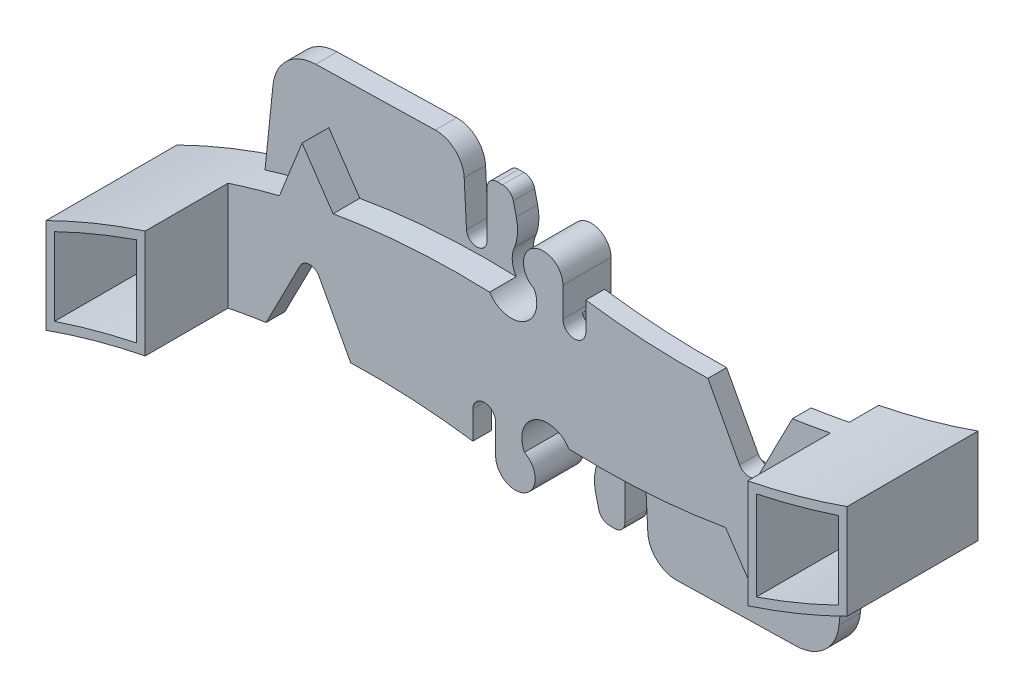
SolidWorks part; units mm, degrees
ref_plane "Спереди" through (0, 0, 0) normal (0, 0, 1) x (1, 0, 0)
ref_plane "Сверху" through (0, 0, 0) normal (0, 1, 0) x (1, 0, 0)
ref_plane "Справа" through (0, 0, 0) normal (1, 0, 0) x (0, 0, -1)
sketch "Эскиз1" plane through (0, 0, 0) normal (0, 0, 1) x (1, 0, 0)
  line L0 (-375.3024, 31.4014) -> (374.6976, 31.4014) construction
  line L24 (0, -241.3413) -> (0, -81.7204) construction
  line L25 (-375, -116.0042) -> (375, 116.0042) construction
  line L26 (375, -116.0042) -> (375, 116.0042) construction
  line L27 (-375, 116.0042) -> (375, 116.0042) construction
  line L28 (-375, -116.0042) -> (-375, 116.0042) construction
  line L29 (-375, -116.0042) -> (375, -116.0042) construction
  line L30 (-375, 116.0042) -> (375, -116.0042) construction
  line L31 (-212.6838, 78.1092) -> (-233.9079, 24.7709)
  line L32 (-212.6838, 78.1092) -> (-183.648, 35.3622)
  line L33 (-54.9859, 113.0917) -> (-50.0582, 113.0917)
  line L34 (-31.5, -57.5287) -> (-31.5, -85)
  line L35 (-64.536, 60.32) -> (-64.536, 103.5416)
  line L36 (-52.8148, -83.6396) -> (-52.8148, -57.5287)
  line L37 (-214.458, -22.1116) -> (-246.2919, -84.1777)
  line L38 (-85.939, 100.8712) -> (-83.813, 59.8211)
  line L39 (0, 0) -> (561.0349, 0) construction
  line L55 (-167.1856, -77.2946) -> (-196.7642, -22.1116)
  line L56 (-224.9261, 123.3927) -> (-113.0702, 126.0318)
  line L57 (-39.9761, 105.1282) -> (-37.178, 93.3762)
  line L58 (-272.3711, 14.0006) -> (-264.9369, 86.4136)
  line L59 (-282, 10.9287) -> (-282, -90.3668)
  line L60 (-374.8948, -27.081) -> (-374.8948, -116.0042)
  line L61 (0, 0) -> (-272.3711, 14.0006)
  line L62 (212.6838, -78.1092) -> (233.9079, -24.7709)
  line L63 (212.6838, -78.1092) -> (183.648, -35.3622)
  line L64 (54.9859, -113.0917) -> (50.0582, -113.0917)
  line L65 (31.5, 57.5287) -> (31.5, 85)
  line L66 (64.536, -60.32) -> (64.536, -103.5416)
  line L67 (52.92, 83.6396) -> (52.92, 57.5287)
  line L68 (214.458, 22.1116) -> (246.2919, 84.1777)
  line L69 (0, -70.9199) -> (0, 278.9356)
  line L70 (85.939, -100.8712) -> (83.813, -59.8211)
  line L71 (167.1856, 77.2946) -> (196.7642, 22.1116)
  line L72 (224.9261, -123.3927) -> (113.0702, -126.0318)
  line L73 (39.9761, -105.1282) -> (37.178, -93.3762)
  line L74 (272.3711, -14.0006) -> (264.9369, -86.4136)
  line L75 (282, -10.9287) -> (282, 90.3668)
  line L76 (375, 27.081) -> (375, 116.0042)
  line L77 (0, 0) -> (272.3711, -14.0006)
  arc A12 (4.564, 68.5354) -> (-38.7133, 68.2242) centre (-17, 58) cw
  arc A13 (-196.7642, -22.1116) -> (-214.458, -22.1116) centre (-205.6111, -26.8536) ccw
  arc A14 (-37.178, 93.3762) -> (-38.7133, 68.2242) centre (-79.3762, 83.3291) cw
  arc A15 (-64.536, 60.32) -> (-83.813, 59.8211) centre (-74.181, 60.32) cw
  arc A16 (-54.9859, 113.0917) -> (-64.536, 103.5416) centre (-54.9859, 103.5416) ccw
  arc A17 (-39.9761, 105.1282) -> (-50.0582, 113.0917) centre (-50.0582, 102.7277) ccw
  arc A18 (-224.9261, 123.3927) -> (-264.9369, 86.4136) centre (-223.9544, 82.2062) ccw
  arc A19 (-85.939, 100.8712) -> (-113.0702, 126.0318) centre (-112.4442, 99.4984) ccw
  arc A20 (-52.8148, -83.6396) -> (-374.8948, -116.0042) centre (-147.6226, -758.9402) ccw
  arc A21 (-31.5, -57.5287) -> (-52.8148, -57.5287) centre (-42.1574, -57.5287) ccw
  arc A22 (-37.0728, 45.0059) -> (-374.8948, -27.081) centre (-64.6411, -653.4149) ccw
  arc A23 (4.564, 68.5354) -> (31.5, 85) centre (13, 85) cw
  arc A25 (-4.564, -68.5354) -> (38.8196, -67.9952) centre (17, -58) cw
  arc A37 (196.7642, 22.1116) -> (214.458, 22.1116) centre (205.6111, 26.8536) ccw
  arc A38 (37.178, -93.3762) -> (38.8196, -67.9952) centre (79.2676, -83.3549) cw
  arc A39 (64.536, -60.32) -> (83.813, -59.8211) centre (74.181, -60.32) cw
  arc A40 (54.9859, -113.0917) -> (64.536, -103.5416) centre (54.9859, -103.5416) ccw
  arc A41 (39.9761, -105.1282) -> (50.0582, -113.0917) centre (50.0582, -102.7277) ccw
  arc A42 (224.9261, -123.3927) -> (264.9369, -86.4136) centre (223.9544, -82.2062) ccw
  arc A43 (85.939, -100.8712) -> (113.0702, -126.0318) centre (112.4442, -99.4984) ccw
  arc A44 (-4.564, -68.5354) -> (-31.5, -85) centre (-13, -85) cw
  arc A45 (52.92, 83.6396) -> (375, 116.0042) centre (147.7278, 758.9402) ccw
  arc A46 (31.5, 57.5287) -> (52.92, 57.5287) centre (42.21, 57.5287) ccw
  arc A47 (37.178, -45.0059) -> (375, 27.081) centre (64.7463, 653.4149) ccw
  dimension "D1" = 750
sketch "Эскиз2" plane through (0, 0, 0) normal (0, 0, 1) x (1, 0, 0)
  line L0 (-374.8948, -27.081) -> (-374.8948, -116.0042) construction
  line L1 (-52.8148, -83.6396) -> (-52.8148, -57.5287) construction
  line L2 (-31.5, -57.5287) -> (-31.5, -85) construction
  line L3 (39.9761, -105.1282) -> (37.178, -93.3762) construction
  line L4 (54.9859, -113.0917) -> (50.0582, -113.0917) construction
  line L5 (64.536, -60.32) -> (64.536, -103.5416) construction
  line L6 (85.939, -100.8712) -> (83.813, -59.8211) construction
  line L7 (224.9261, -123.3927) -> (113.0702, -126.0318) construction
  line L8 (272.3711, -14.0006) -> (264.9369, -86.4136) construction
  line L11 (-272.3711, 14.0006) -> (-264.9369, 86.4136) construction
  line L12 (-224.9261, 123.3927) -> (-113.0702, 126.0318) construction
  line L13 (-85.939, 100.8712) -> (-83.813, 59.8211) construction
  line L14 (-64.536, 60.32) -> (-64.536, 103.5416) construction
  line L15 (-54.9859, 113.0917) -> (-50.0582, 113.0917) construction
  line L16 (-39.9761, 105.1282) -> (-37.178, 93.3762) construction
  line L17 (31.5, 57.5287) -> (31.5, 85) construction
  line L18 (52.92, 83.6396) -> (52.92, 57.5287) construction
  line L19 (375, 27.081) -> (375, 116.0042) construction
  line L22 (-214.458, -22.1116) -> (-246.2919, -84.1777) construction
  line L23 (-167.1856, -77.2946) -> (-196.7642, -22.1116) construction
  line L27 (214.458, 22.1116) -> (246.2919, 84.1777) construction
  line L28 (167.1856, 77.2946) -> (196.7642, 22.1116) construction
  line L31 (-374.8948, -27.081) -> (-374.8948, -116.0042)
  line L32 (-52.8148, -83.6396) -> (-52.8148, -57.5287)
  line L33 (-31.5, -57.5287) -> (-31.5, -85)
  line L34 (39.9761, -105.1282) -> (37.178, -93.3762)
  line L35 (54.9859, -113.0917) -> (50.0582, -113.0917)
  line L36 (64.536, -60.32) -> (64.536, -103.5416)
  line L37 (85.939, -100.8712) -> (83.813, -59.8211)
  line L38 (224.9261, -123.3927) -> (113.0702, -126.0318)
  line L39 (272.3711, -14.0006) -> (264.9369, -86.4136)
  line L42 (-272.3745, 13.9668) -> (-264.9369, 86.4136)
  line L43 (-224.9261, 123.3927) -> (-113.0702, 126.0318)
  line L44 (-85.939, 100.8712) -> (-83.813, 59.8211)
  line L45 (-64.536, 60.32) -> (-64.536, 103.5416)
  line L46 (-54.9859, 113.0917) -> (-50.0582, 113.0917)
  line L47 (-39.9761, 105.1282) -> (-37.178, 93.3762)
  line L48 (31.5, 57.5287) -> (31.5, 85)
  line L49 (52.92, 83.6396) -> (52.92, 57.5287)
  line L50 (375, 27.081) -> (375, 116.0042)
  line L53 (-214.458, -22.1116) -> (-246.3005, -84.1943)
  line L54 (-167.184, -77.2975) -> (-196.7642, -22.1116)
  line L58 (214.458, 22.1116) -> (246.2919, 84.1777)
  line L59 (167.1856, 77.2946) -> (196.7642, 22.1116)
  arc A1 (-52.8148, -83.6396) -> (-374.8948, -116.0042) centre (-147.6226, -758.9402) ccw construction
  arc A2 (-31.5, -57.5287) -> (-52.8148, -57.5287) centre (-42.1574, -57.5287) ccw construction
  arc A3 (-31.5, -85) -> (-4.564, -68.5354) centre (-13, -85) ccw construction
  arc A4 (38.8196, -67.9952) -> (-4.564, -68.5354) centre (17, -58) ccw construction
  arc A5 (38.8196, -67.9952) -> (37.178, -93.3762) centre (79.2676, -83.3549) ccw construction
  arc A6 (39.9761, -105.1282) -> (50.0582, -113.0917) centre (50.0582, -102.7277) ccw construction
  arc A7 (54.9859, -113.0917) -> (64.536, -103.5416) centre (54.9859, -103.5416) ccw construction
  arc A8 (83.813, -59.8211) -> (64.536, -60.32) centre (74.181, -60.32) ccw construction
  arc A9 (85.939, -100.8712) -> (113.0702, -126.0318) centre (112.4442, -99.4984) ccw construction
  arc A10 (224.9261, -123.3927) -> (264.9369, -86.4136) centre (223.9544, -82.2062) ccw construction
  arc A11 (-224.9261, 123.3927) -> (-264.9369, 86.4136) centre (-223.9544, 82.2062) ccw construction
  arc A12 (-85.939, 100.8712) -> (-113.0702, 126.0318) centre (-112.4442, 99.4984) ccw construction
  arc A13 (-83.813, 59.8211) -> (-64.536, 60.32) centre (-74.181, 60.32) ccw construction
  arc A14 (-54.9859, 113.0917) -> (-64.536, 103.5416) centre (-54.9859, 103.5416) ccw construction
  arc A15 (-39.9761, 105.1282) -> (-50.0582, 113.0917) centre (-50.0582, 102.7277) ccw construction
  arc A16 (-38.7133, 68.2242) -> (-37.178, 93.3762) centre (-79.3762, 83.3291) ccw construction
  arc A17 (-38.7133, 68.2242) -> (4.564, 68.5354) centre (-17, 58) ccw construction
  arc A18 (31.5, 85) -> (4.564, 68.5354) centre (13, 85) ccw construction
  arc A19 (31.5, 57.5287) -> (52.92, 57.5287) centre (42.21, 57.5287) ccw construction
  arc A20 (52.92, 83.6396) -> (375, 116.0042) centre (147.7278, 758.9402) ccw construction
  arc A21 (37.178, -45.0059) -> (375, 27.081) centre (64.7463, 653.4149) ccw construction
  arc A22 (-196.7642, -22.1116) -> (-214.458, -22.1116) centre (-205.6111, -26.8536) ccw construction
  arc A23 (196.7642, 22.1116) -> (214.458, 22.1116) centre (205.6111, 26.8536) ccw construction
  arc A25 (-52.8148, -83.6396) -> (-167.184, -77.2975) centre (-147.6226, -758.9402) ccw
  arc A26 (-31.5, -57.5287) -> (-52.8148, -57.5287) centre (-42.1574, -57.5287) ccw
  arc A27 (-31.5, -85) -> (-4.564, -68.5354) centre (-13, -85) ccw
  arc A28 (38.8196, -67.9952) -> (-4.564, -68.5354) centre (17, -58) ccw
  arc A29 (38.8196, -67.9952) -> (37.178, -93.3762) centre (79.2676, -83.3549) ccw
  arc A30 (39.9761, -105.1282) -> (50.0582, -113.0917) centre (50.0582, -102.7277) ccw
  arc A31 (54.9859, -113.0917) -> (64.536, -103.5416) centre (54.9859, -103.5416) ccw
  arc A32 (83.813, -59.8211) -> (64.536, -60.32) centre (74.181, -60.32) ccw
  arc A33 (85.939, -100.8712) -> (113.0702, -126.0318) centre (112.4442, -99.4984) ccw
  arc A34 (224.9261, -123.3927) -> (264.9369, -86.4136) centre (223.9544, -82.2062) ccw
  arc A35 (-224.9261, 123.3927) -> (-264.9369, 86.4136) centre (-223.9544, 82.2062) ccw
  arc A36 (-85.939, 100.8712) -> (-113.0702, 126.0318) centre (-112.4442, 99.4984) ccw
  arc A37 (-83.813, 59.8211) -> (-64.536, 60.32) centre (-74.181, 60.32) ccw
  arc A38 (-54.9859, 113.0917) -> (-64.536, 103.5416) centre (-54.9859, 103.5416) ccw
  arc A39 (-39.9761, 105.1282) -> (-50.0582, 113.0917) centre (-50.0582, 102.7277) ccw
  arc A40 (-38.7133, 68.2242) -> (-37.178, 93.3762) centre (-79.3762, 83.3291) ccw
  arc A41 (-38.7133, 68.2242) -> (4.564, 68.5354) centre (-17, 58) ccw
  arc A42 (31.5, 85) -> (4.564, 68.5354) centre (13, 85) ccw
  arc A43 (31.5, 57.5287) -> (52.92, 57.5287) centre (42.21, 57.5287) ccw
  arc A44 (52.92, 83.6396) -> (167.1856, 77.2946) centre (147.7278, 758.9402) ccw
  arc A45 (272.3711, -14.0006) -> (375, 27.081) centre (64.7463, 653.4149) ccw
  arc A46 (-196.7642, -22.1116) -> (-214.458, -22.1116) centre (-205.6111, -26.8536) ccw
  arc A47 (196.7642, 22.1116) -> (214.458, 22.1116) centre (205.6111, 26.8536) ccw
  arc A48 (246.2919, 84.1777) -> (375, 116.0042) centre (147.7278, 758.9402) ccw
  arc A49 (-246.3005, -84.1943) -> (-374.8948, -116.0042) centre (-147.6226, -758.9402) ccw
  arc A50 (-272.3745, 13.9668) -> (-374.8948, -27.081) centre (-64.6411, -653.4149) ccw
extrude "Бобышка-Вытянуть1" add sketch "Эскиз2" along normal mid plane 45
sketch "Эскиз3" plane through (0, 0, 0) normal (0, 0, 1) x (1, 0, 0)
  line L0 (-212.6838, 78.1092) -> (-233.9079, 24.7709) construction
  line L1 (212.6838, -78.1092) -> (233.9079, -24.7709) construction
  line L2 (212.6838, -78.1092) -> (183.648, -35.3622) construction
  line L3 (-212.6838, 78.1092) -> (-183.648, 35.3622) construction
  line L4 (212.6838, -78.1092) -> (233.9079, -24.7709)
  line L5 (212.6838, -78.1092) -> (183.648, -35.3622)
  line L6 (-212.6838, 78.1092) -> (-183.6369, 35.346)
  line L7 (-212.6838, 78.1092) -> (-233.9195, 24.7417)
  line L8 (-374.8948, -27.081) -> (-374.8948, 190.3826)
  line L9 (-374.8948, 190.3826) -> (-22.4115, 190.3826)
  line L10 (-22.4115, 190.3826) -> (-22.4115, 44.2729)
  line L11 (375, 27.081) -> (375, -189.5585)
  line L12 (375, -189.5585) -> (28.8988, -189.5585)
  line L13 (28.8988, -189.5585) -> (28.8988, -44.6299)
  arc A0 (37.178, -45.0059) -> (375, 27.081) centre (64.7463, 653.4149) ccw construction
  arc A1 (-37.0728, 45.0059) -> (-374.8948, -27.081) centre (-64.6411, -653.4149) ccw construction
  arc A2 (28.8988, -44.6299) -> (183.648, -35.3622) centre (64.7463, 653.4149) ccw
  arc A3 (-22.4115, 44.2729) -> (-183.6369, 35.346) centre (-64.6411, -653.4149) ccw
  arc A4 (233.9079, -24.7709) -> (375, 27.081) centre (64.7463, 653.4149) ccw
  arc A5 (-233.9195, 24.7417) -> (-374.8948, -27.081) centre (-64.6411, -653.4149) ccw
extrude "Вырез-Вытянуть1" cut sketch "Эскиз3" along normal blind 22.5 and the other way blind 2.5
sketch "Эскиз4" plane through (0, 0, 0) normal (0, 0, 1) x (1, 0, 0)
  line L0 (282, -10.9287) -> (282, 90.3668) construction
  line L1 (-282, 10.9287) -> (-282, -90.3668) construction
  line L2 (32, 191.573) -> (32, 22.103)
  line L3 (0, 0) -> (272.3711, -14.0006) construction
  line L4 (282, 32.8769) -> (282, 90.3668)
  line L5 (-282, -32.8769) -> (-282, -90.3668)
  line L6 (55.7166, -2.864) -> (234.6899, -12.0637)
  line L7 (-234.6899, 12.0637) -> (-55.7166, 2.864)
  line L8 (-32, -226.8105) -> (-32, -22.103)
  line L9 (-282, -90.3668) -> (-32, -226.8105)
  line L10 (32, 191.573) -> (282, 90.3668)
  arc A0 (234.6899, -12.0637) -> (282, 32.8769) centre (237, 32.8769) ccw
  arc A1 (-234.6899, 12.0637) -> (-282, -32.8769) centre (-237, -32.8769) ccw
  arc A2 (32, 22.103) -> (55.7166, -2.864) centre (57, 22.103) ccw
  arc A3 (-32, -22.103) -> (-55.7166, 2.864) centre (-57, -22.103) ccw
  point P19 (32, -1.6449)
extrude "Вырез-Вытянуть2" cut sketch "Эскиз4" against normal blind 25 and the other way blind 5
sketch "Эскиз5" plane through (0, 0, 0) normal (0, 0, 1) x (1, 0, 0)
  line L0 (282, -10.9287) -> (282, 90.3668) construction
  line L1 (-282, 10.9287) -> (-282, -90.3668) construction
  line L2 (-374.8948, -27.081) -> (-374.8948, -116.0042) construction
  line L3 (375, 27.081) -> (375, 116.0042) construction
  line L4 (-282, 10.8943) -> (-282, -90.388)
  line L5 (-374.8948, -27.081) -> (-374.8948, -116.0042)
  line L6 (375, 27.081) -> (375, 116.0042)
  line L7 (282, -10.9287) -> (282, 90.3668)
  arc A0 (-52.8148, -83.6396) -> (-374.8948, -116.0042) centre (-147.6226, -758.9402) ccw construction
  arc A1 (-37.0728, 45.0059) -> (-374.8948, -27.081) centre (-64.6411, -653.4149) ccw construction
  arc A2 (52.92, 83.6396) -> (375, 116.0042) centre (147.7278, 758.9402) ccw construction
  arc A3 (37.178, -45.0059) -> (375, 27.081) centre (64.7463, 653.4149) ccw construction
  arc A4 (-282, -90.388) -> (-374.8948, -116.0042) centre (-147.6226, -758.9402) ccw
  arc A5 (-282, 10.8943) -> (-374.8948, -27.081) centre (-64.6411, -653.4149) ccw
  arc A6 (282, 90.3668) -> (375, 116.0042) centre (147.7278, 758.9402) ccw
  arc A7 (282, -10.9287) -> (375, 27.081) centre (64.7463, 653.4149) ccw
extrude "Бобышка-Вытянуть2" add sketch "Эскиз5" along normal blind 100
sketch "Эскиз6" plane through (0, 0, 100) normal (0, 0, 1) x (1, 0, 0)
  line L4 (-366.8948, -32.0657) -> (-366.8948, -104.789)
  line L5 (-290, -83.8678) -> (-290, -0.2339)
  line L6 (-366.8948, -32.0657) -> (-366.8948, -104.789)
  line L7 (-290, -83.8678) -> (-290, -0.2339)
  line L10 (367, 32.0657) -> (367, 104.789)
  line L11 (290, 83.8456) -> (290, 0.1976)
  line L12 (367, 32.0657) -> (367, 104.789)
  line L13 (290, 83.8456) -> (290, 0.1976)
  arc A4 (-290, -83.8678) -> (-366.8948, -104.789) centre (-147.6226, -758.9402) ccw
  arc A5 (-290, -0.2339) -> (-366.8948, -32.0657) centre (-64.6411, -653.4149) ccw
  arc A6 (-290, -83.8678) -> (-366.8948, -104.789) centre (-147.6226, -758.9402) ccw
  arc A7 (-290, -0.2339) -> (-366.8948, -32.0657) centre (-64.6411, -653.4149) ccw
  arc A10 (290, 0.1976) -> (367, 32.0657) centre (64.7463, 653.4149) ccw
  arc A11 (290, 83.8456) -> (367, 104.789) centre (147.7278, 758.9402) ccw
  arc A12 (290, 0.1976) -> (367, 32.0657) centre (64.7463, 653.4149) ccw
  arc A13 (290, 83.8456) -> (367, 104.789) centre (147.7278, 758.9402) ccw
  dimension "D1" = 8
  dimension "D2" = 8
extrude "Вырез-Вытянуть3" cut sketch "Эскиз6" against normal blind 120 and the other way through all
scale "Масштаб1" scale about origin uniform scaling yes scale factor 0.1
equation "\"D3@Эскиз4\"=\"D2@Эскиз4\""
